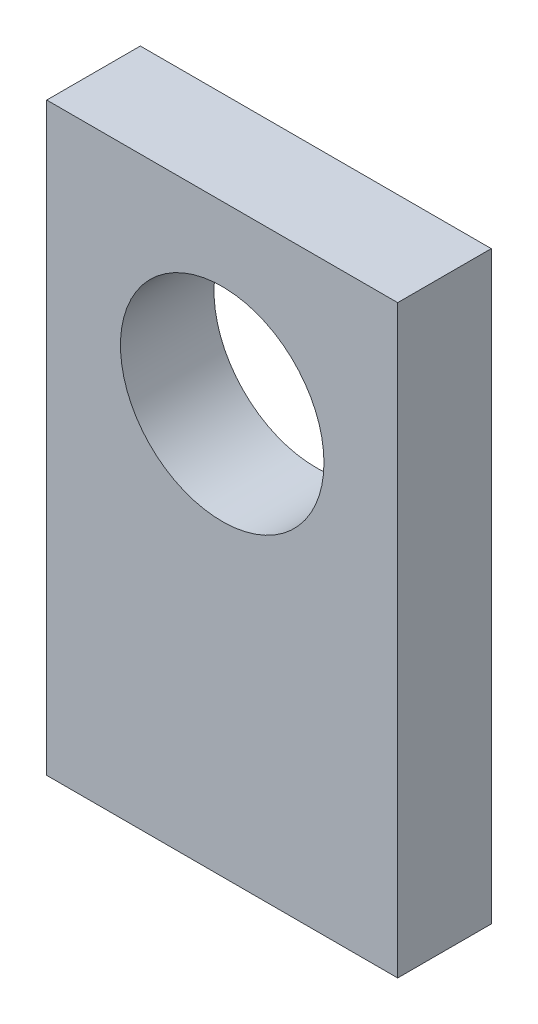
SolidWorks part; units mm, degrees
ref_plane "Front Plane" through (0, 0, 0) normal (0, 0, 1) x (1, 0, 0)
ref_plane "Top Plane" through (0, 0, 0) normal (0, 1, 0) x (1, 0, 0)
ref_plane "Right Plane" through (0, 0, 0) normal (1, 0, 0) x (0, 0, -1)
sketch "Sketch1" plane through (0, 0, 0) normal (0, 0, 1) x (1, 0, 0)
  line L0 (19.05, 44.45) -> (19.05, 0) construction
  line L1 (0, 0) -> (38.1, 0)
  line L2 (0, 0) -> (0, 63.5)
  line L3 (0, 63.5) -> (38.1, 63.5)
  line L4 (38.1, 0) -> (38.1, 63.5)
  circle A0 centre (19.05, 44.45) radius 11.049
  dimension "D3" = 22.098
  dimension "D4" = 44.45
  dimension "D1" = 38.1
  dimension "D2" = 63.5
extrude "Extrude1" add sketch "Sketch1" along normal blind 10.16
hole_wizard "#10-32 Tapped Hole1" positions "Sketch3" profile "Sketch2" tap size "#10-32" standard "Ansi Inch"
sketch "Sketch3" plane through (0, 0, 0) normal (0, -1, 0) x (1, 0, 0)
  line L0 (0, 5.08) -> (38.1, 5.08) construction
  line L1 (0, 10.16) -> (0, 0) construction
  line L2 (38.1, 10.16) -> (38.1, 0) construction
  line L3 (19.05, 5.08) -> (19.05, 0) construction
  line L4 (0, 0) -> (38.1, 0) construction
  point P0 (6.35, 5.08)
  point P16 (31.75, 5.08)
  dimension "D1" = 25.4
sketch "Sketch2" plane through (6.35, 0, 5.08) normal (1, 0, 0) x (0, 0, -1)
  line L0 (0, 0) -> (0, 14.9293)
  line L1 (0, 14.9293) -> (2.0193, 13.716)
  line L2 (2.0193, 13.716) -> (2.0193, 0)
  line L5 (2.0193, 0) -> (0, 0)
  line L10 (0, 14.9293) -> (-2.0193, 13.716) construction
  line L11 (0, -6.35) -> (0, 107.95) construction
  dimension "Tap Drill Dia." = 4.0386
  dimension "Tap Drill Depth" = 13.716
  dimension "Drill Angle" = 118
